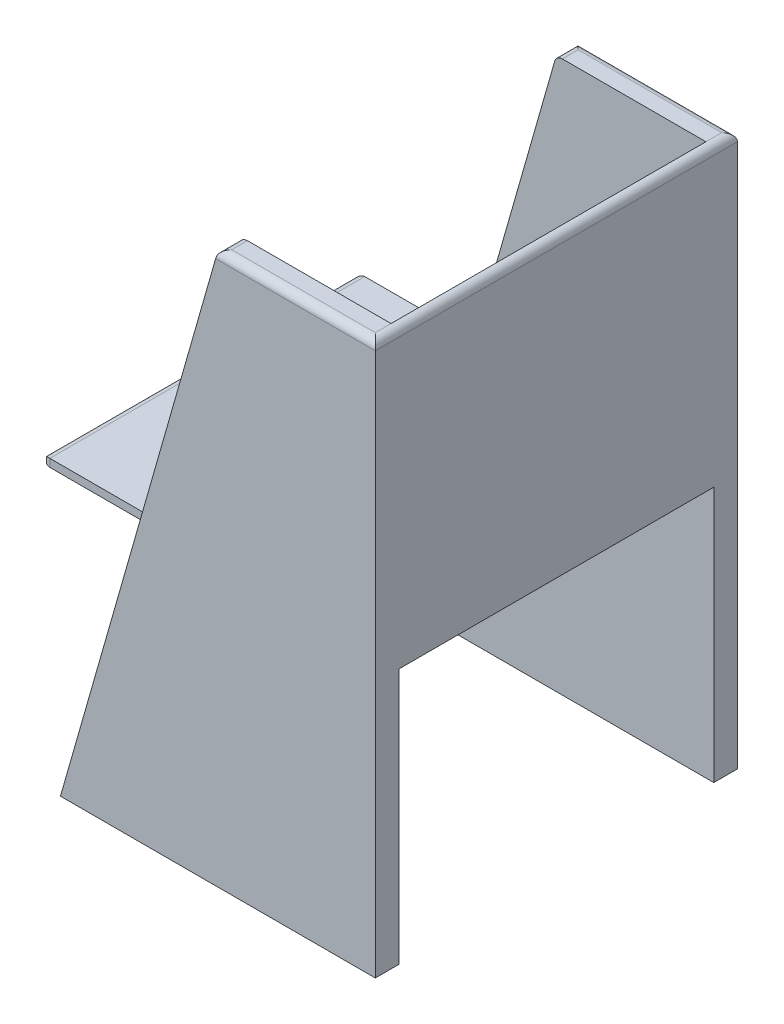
SolidWorks part; units mm, degrees
ref_plane "Front Plane" through (0, 0, 0) normal (0, 0, 1) x (1, 0, 0)
ref_plane "Top Plane" through (0, 0, 0) normal (0, 1, 0) x (1, 0, 0)
ref_plane "Right Plane" through (0, 0, 0) normal (1, 0, 0) x (0, 0, -1)
sketch "Sketch1" plane through (0, 0, 0) normal (0, 0, 1) x (1, 0, 0)
  line L0 (0, 0) -> (400, 0)
  line L1 (400, 0) -> (400, 700)
  line L2 (400, 700) -> (200, 700)
  line L3 (200, 700) -> (0, 0)
  point P0 (339.2012, 1000)
  dimension "D1" = 400
  dimension "D2" = 700
  dimension "D3" = 200
extrude "Boss-Extrude1" add sketch "Sketch1" along normal blind 30
sketch "Sketch2" plane through (400, 0, 0) normal (1, 0, 0) x (0, 0, -1)
  line L0 (0, 375) -> (-450, 375)
  line L1 (0, 0) -> (0, 700) construction
  line L2 (-450, 375) -> (-450, 325)
  line L3 (-450, 325) -> (0, 325)
  line L4 (0, 325) -> (0, 375)
  line L5 (-450, 350) -> (0, 350) construction
  dimension "D1" = 50
  dimension "D2" = 450
extrude "Boss-Extrude2" add sketch "Sketch2" against normal blind 10
ref_plane "Plane1" through (0, 0, 230) normal (0, 0, 1) x (1, 0, 0)
mirror "Mirror1" about plane through (0, 0, 230) normal (0, 0, 1) of "Boss-Extrude1"
sketch "Sketch3" plane through (400, 0, 0) normal (1, 0, 0) x (0, 0, -1)
  line L1 (-430, 375) -> (-30, 375)
  line L2 (-430, 375) -> (-430, 700)
  line L3 (-430, 700) -> (-30, 700)
  line L4 (-30, 375) -> (-30, 700)
extrude "Boss-Extrude3" add sketch "Sketch3" against normal blind 10
sketch "Sketch4" plane through (0, 325, 0) normal (0, -1, 0) x (1, 0, 0)
  line L1 (390, 430) -> (-53.4845, 430)
  line L2 (390, 430) -> (390, 30)
  line L3 (390, 30) -> (-53.4845, 30)
  line L4 (-53.4845, 430) -> (-53.4845, 30)
extrude "Boss-Extrude4" add sketch "Sketch4" against normal blind 10
fillet "Fillet1" radius 10 8 edges at (-53.4845, 335, 230) (200, 700, 445) (300, 700, 460) (300, 700, 0) (400, 700, 230) (200, 700, 15) (-53.4845, 330, 30) (-53.4845, 330, 430)
